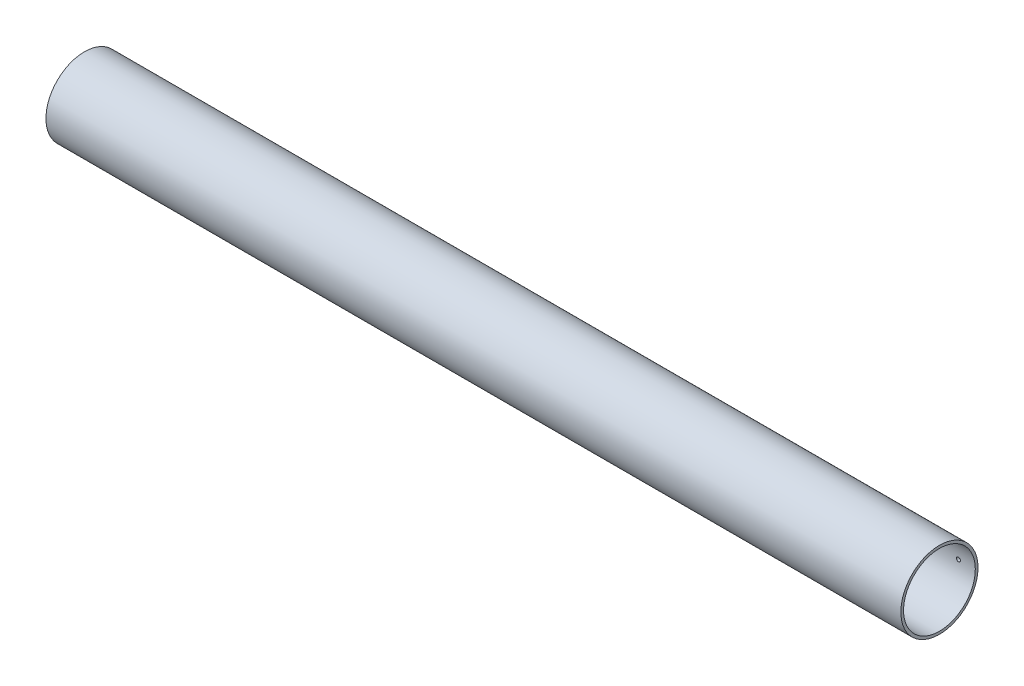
SolidWorks part; units mm, degrees
ref_plane "Front Plane" through (0, 0, 0) normal (0, 0, 1) x (1, 0, 0)
ref_plane "Top Plane" through (0, 0, 0) normal (0, 1, 0) x (1, 0, 0)
ref_plane "Right Plane" through (0, 0, 0) normal (1, 0, 0) x (0, 0, -1)
sketch "Sketch1" plane through (0, 0, 0) normal (1, 0, 0) x (0, 0, -1)
  circle A0 centre (0, 0) radius 29.083
  circle A1 centre (0, 0) radius 27.051
  dimension "D1" = 58.166
  dimension "D2" = 54.102
extrude "Extrude1" add sketch "Sketch1" along normal blind 644.525
sketch "Sketch2" plane through (0, 0, 0) normal (0, 0, 1) x (1, 0, 0)
  line L0 (0, 29.083) -> (0, -29.083) construction
  line L1 (644.525, -29.083) -> (644.525, 29.083) construction
  circle A0 centre (10.16, 0) radius 1.524
  circle A1 centre (631.825, 0) radius 1.524
  dimension "D3" = 3.048
  dimension "D4" = 3.048
  dimension "D1" = 10.16
  dimension "D2" = 12.7
extrude "Cut-Extrude1" cut sketch "Sketch2" against normal through all
